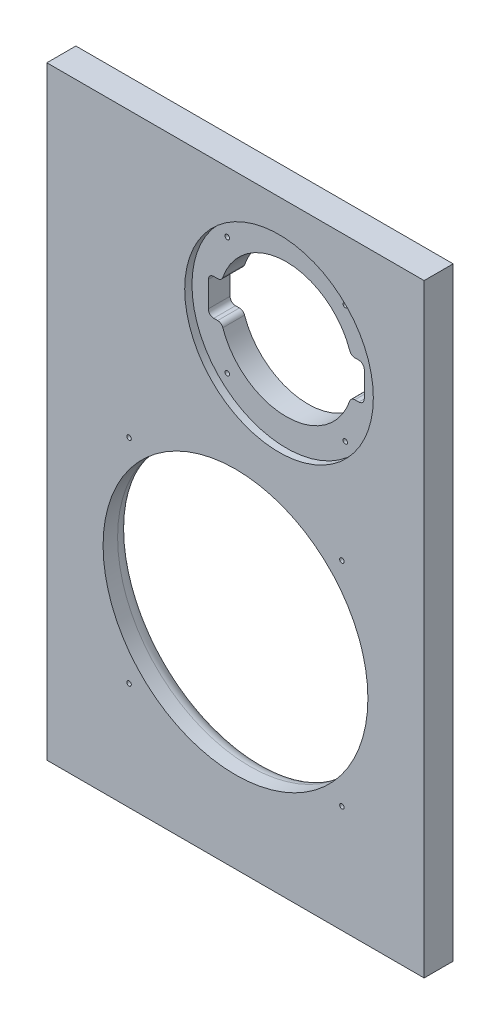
SolidWorks part; units mm, degrees
ref_plane "Спереди" through (0, 0, 0) normal (0, 0, 1) x (1, 0, 0)
ref_plane "Сверху" through (0, 0, 0) normal (0, 1, 0) x (1, 0, 0)
ref_plane "Справа" through (0, 0, 0) normal (1, 0, 0) x (0, 0, -1)
sketch "Эскиз1" plane through (0, 0, 0) normal (0, 0, 1) x (1, 0, 0)
  line L0 (0, -10) -> (208, -10)
  line L1 (0, -343) -> (208, -343)
  line L2 (0, -10) -> (0, -343)
  line L4 (208, -10) -> (208, -343)
extrude "Вытянуть1" add sketch "Эскиз1" along normal blind 16
sketch "Эскиз2" plane through (0, 0, 16) normal (0, 0, 1) x (1, 0, 0)
  line L0 (104, -359.0489) -> (104, 19.2273) construction
  line L1 (168, -69.9973) -> (165.8286, -69.9973)
  line L2 (90.1714, -69.9973) -> (88, -69.9973)
  line L3 (168, -89.9973) -> (165.8286, -89.9973)
  line L4 (90.1714, -89.9973) -> (88, -89.9973)
  line L5 (171, -72.9973) -> (171, -86.9973)
  line L6 (85, -72.9973) -> (85, -86.9973)
  circle A0 centre (104, -224.9973) radius 73
  circle A2 centre (104, -224.9973) radius 88 construction
  circle A3 centre (128, -79.9973) radius 52 construction
  arc A4 (162.9914, -92.0223) -> (93.0086, -92.0223) centre (128, -79.9973) cw
  arc A5 (165.8286, -89.9973) -> (162.9914, -92.0223) centre (165.8286, -92.9973) ccw
  arc A6 (93.0086, -67.9723) -> (90.1714, -69.9973) centre (90.1714, -66.9973) cw
  arc A7 (171, -72.9973) -> (168, -69.9973) centre (168, -72.9973) ccw
  arc A8 (165.8286, -69.9973) -> (162.9914, -67.9723) centre (165.8286, -66.9973) cw
  arc A9 (85, -86.9973) -> (88, -89.9973) centre (88, -86.9973) ccw
  arc A10 (93.0086, -67.9723) -> (162.9914, -67.9723) centre (128, -79.9973) cw
  arc A21 (93.0086, -92.0223) -> (90.1714, -89.9973) centre (90.1714, -92.9973) ccw
  arc A22 (85, -72.9973) -> (88, -69.9973) centre (88, -72.9973) cw
  arc A23 (171, -86.9973) -> (168, -89.9973) centre (168, -86.9973) cw
  point P78 (92.377, -89.9973)
  point P79 (92.377, -69.9973)
  point P80 (163.623, -89.9973)
  dimension "D1" = 146
  dimension "D4" = 176
extrude "Вырез-Вытянуть1" cut sketch "Эскиз2" against normal through all
sketch "Эскиз3" plane through (0, 0, 16) normal (0, 0, 1) x (1, 0, 0)
  line L0 (80, -42.9973) -> (80, -116.9973) construction
  line L1 (104, -2.6321) -> (104, -200.2703) construction
  arc A0 (114.9914, -67.9723) -> (45.0086, -67.9723) centre (80, -79.9973) ccw construction
  arc A1 (45.0086, -92.0223) -> (114.9914, -92.0223) centre (80, -79.9973) ccw construction
  circle A3 centre (128, -79.9973) radius 52
extrude "Вырез-Вытянуть2" cut sketch "Эскиз3" against normal blind 4
sketch "Эскиз7" plane through (0, 0, 16) normal (0, 0, 1) x (1, 0, 0)
  line L0 (104, 0) -> (104, -171.6053) construction
  circle A0 centre (160.5269, -47.4704) radius 1.25
  circle A1 centre (45.3101, -283.6872) radius 1.25
  circle A2 centre (45.3101, -166.3075) radius 1.25
  circle A3 centre (162.6899, -166.3075) radius 1.25
  circle A4 centre (162.6899, -283.6872) radius 1.25
  circle A5 centre (160.5269, -112.5242) radius 1.25
  circle A10 centre (95.4731, -112.5242) radius 1.25
  circle A11 centre (95.4731, -47.4704) radius 1.25
  dimension "D1" = 4
extrude "Вырез-Вытянуть3" cut sketch "Эскиз7" against normal blind 16
fillet "Скругление1" radius 8 1 edges at (177, -224.9973, 0)
sketch "Эскиз8" plane through (0, 0, 16) normal (0, 0, 1) x (1, 0, 0)
  line L0 (0, -10) -> (208, -10)
  line L1 (208, -10) -> (208, -343)
  line L2 (208, -343) -> (0, -343)
  line L3 (0, -343) -> (0, -10)
  line L4 (11, -317.9973) -> (197, -317.9973)
  line L5 (197, -317.9973) -> (197, -22.9973)
  line L6 (11, -22.9973) -> (197, -22.9973)
  line L7 (11, -317.9973) -> (11, -22.9973)
  line L8 (-16, 6) -> (224, 6)
  line L9 (224, 6) -> (224, -359)
  line L10 (224, -359) -> (-16, -359)
  line L11 (-16, -359) -> (-16, 6)
  circle A0 centre (104, -224.9973) radius 88 construction
  dimension "D1" = 176
  dimension "D2" = 16
